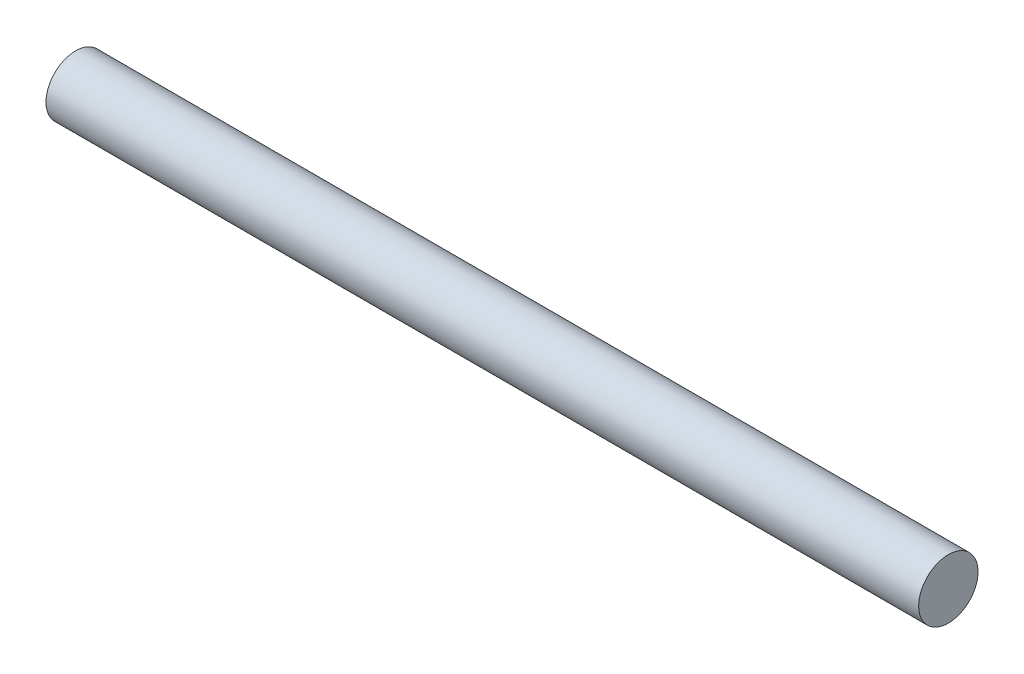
SolidWorks part; units mm, degrees
ref_plane "Front Plane" through (0, 0, 0) normal (0, 0, 1) x (1, 0, 0)
ref_plane "Top Plane" through (0, 0, 0) normal (0, 1, 0) x (1, 0, 0)
ref_plane "Right Plane" through (0, 0, 0) normal (1, 0, 0) x (0, 0, -1)
sketch "Sketch1" plane through (0, 0, 0) normal (0, 0, 1) x (1, 0, 0)
  line L0 (0, 0) -> (0, 4.953)
  line L1 (0, 4.953) -> (145.542, 4.953)
  line L2 (145.542, 4.953) -> (145.542, 0)
  line L3 (145.542, 0) -> (0, 0)
  line L4 (145.542, 0) -> (0, 0) construction
revolve "Revolve1" add sketch "Sketch1" angle 360 about L4
